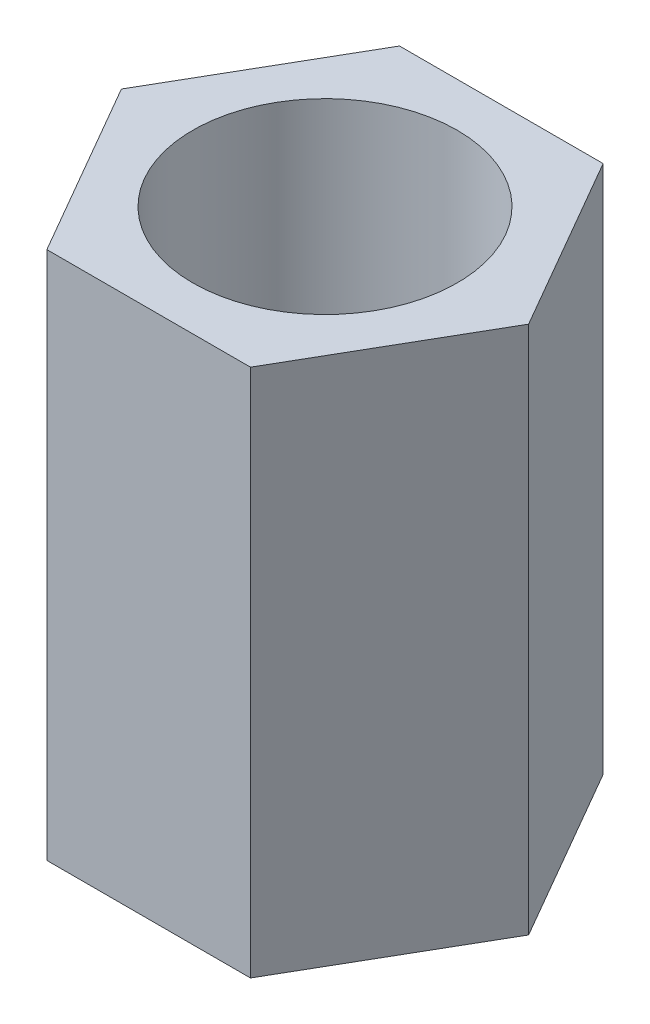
SolidWorks part; units mm, degrees
ref_plane "Alzado" through (0, 0, 0) normal (0, 0, 1) x (1, 0, 0)
ref_plane "Planta" through (0, 0, 0) normal (0, 1, 0) x (1, 0, 0)
ref_plane "Vista lateral" through (0, 0, 0) normal (1, 0, 0) x (0, 0, -1)
sketch "Croquis1" plane through (0, 0, 0) normal (0, 1, 0) x (1, 0, 0)
  line L1 (1.1547, 2) -> (-1.1547, 2)
  line L2 (-1.1547, 2) -> (-2.3094, 0)
  line L3 (-2.3094, 0) -> (-1.1547, -2)
  line L4 (-1.1547, -2) -> (1.1547, -2)
  line L5 (1.1547, -2) -> (2.3094, 0)
  line L6 (2.3094, 0) -> (1.1547, 2)
  circle A0 centre (0, 0) radius 2 construction
  circle A1 centre (0, 0) radius 1.5
  dimension "D1" = 4
  dimension "D2" = 3
extrude "Saliente-Extruir1" add sketch "Croquis1" along normal mid plane 6
